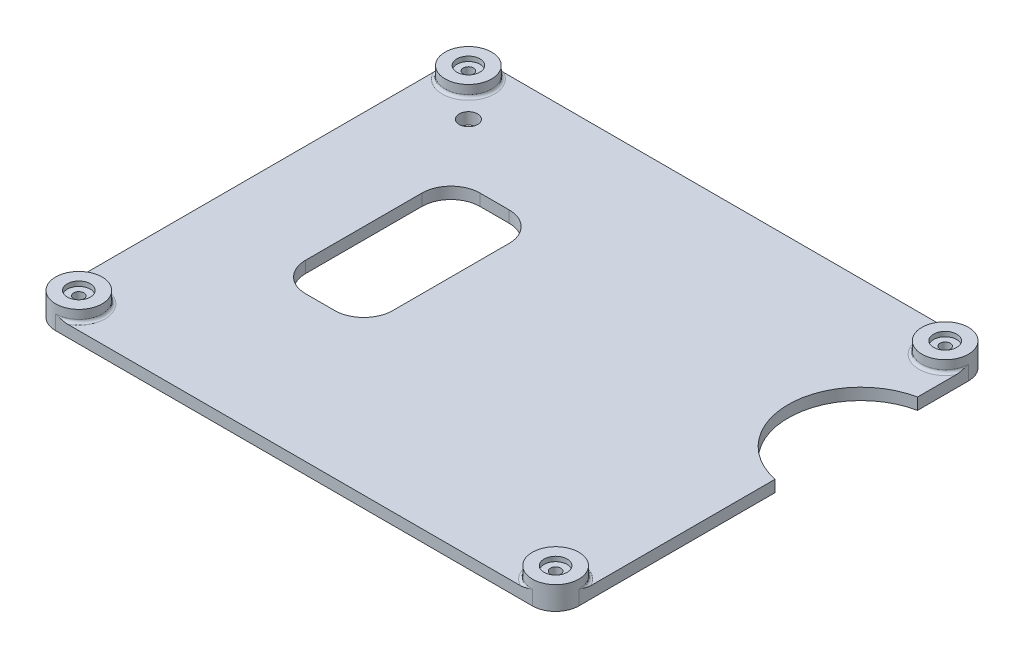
SolidWorks part; units mm, degrees
ref_plane "Front Plane" through (0, 0, 0) normal (0, 0, 1) x (1, 0, 0)
ref_plane "Top Plane" through (0, 0, 0) normal (0, 1, 0) x (1, 0, 0)
ref_plane "Right Plane" through (0, 0, 0) normal (1, 0, 0) x (0, 0, -1)
sketch "Sketch1" plane through (0, 0, 0) normal (0, 1, 0) x (1, 0, 0)
  line L1 (-45, -37.5) -> (45, -37.5)
  line L2 (-45, -37.5) -> (-45, 37.5)
  line L3 (-45, 37.5) -> (45, 37.5)
  line L4 (45, -37.5) -> (45, 37.5)
  line L5 (0, -37.5) -> (0, 37.5) construction
  dimension "D1" = 90
  dimension "D2" = 75
extrude "plate" add sketch "Sketch1" along normal blind 2
fillet "fillet.plate corners" radius 4 4 edges at (45, 1, 37.5) (45, 1, -37.5) (-45, 1, -37.5) (-45, 1, 37.5)
sketch "Sketch12" plane through (0, 2, 0) normal (0, 1, 0) x (-1, 0, 0)
  line L1 (-41, -37.5) -> (41, -37.5) construction
  line L2 (-45, 33.5) -> (-45, -33.5) construction
  arc A1 (-45, -24.7474) -> (-45, -0.2526) centre (-47.5, -12.5) ccw
  dimension "D1" = 25
  dimension "D3" = 12.5
  dimension "D2" = 10
extrude "circular cut" cut sketch "Sketch12" against normal through all and the other way through all
sketch "Sketch2" plane through (0, 2, 0) normal (0, 1, 0) x (1, 0, 0)
  line L0 (41, 37.5) -> (-41, 37.5) construction
  line L1 (-23, 17.5) -> (-18, 17.5)
  line L2 (-28, 12.5) -> (-28, -7.5)
  line L3 (-23, -12.5) -> (-18, -12.5)
  line L4 (-13, 12.5) -> (-13, -7.5)
  line L5 (45, -33.5) -> (45, 0.2526) construction
  arc A0 (-23, 17.5) -> (-28, 12.5) centre (-23, 12.5) ccw
  arc A1 (-18, 17.5) -> (-13, 12.5) centre (-18, 12.5) cw
  arc A2 (-18, -12.5) -> (-13, -7.5) centre (-18, -7.5) ccw
  arc A3 (-28, -7.5) -> (-23, -12.5) centre (-23, -7.5) ccw
  dimension "D1" = 5
  dimension "D2" = 15
  dimension "D3" = 30
  dimension "D4" = 58
  dimension "D5" = 20
extrude "rectangular cut" cut sketch "Sketch2" against normal through all
sketch "Sketch7" plane through (0, 2, 0) normal (0, 1, 0) x (1, 0, 0)
  circle A0 centre (-41, -33.5) radius 4
  circle A1 centre (-41, 33.5) radius 4
  circle A2 centre (41, 33.5) radius 4
  circle A3 centre (41, -33.5) radius 4
  arc A4 (41, -37.5) -> (45, -33.5) centre (41, -33.5) ccw construction
  arc A5 (45, 33.5) -> (41, 37.5) centre (41, 33.5) ccw construction
  arc A6 (-41, 37.5) -> (-45, 33.5) centre (-41, 33.5) ccw construction
  arc A7 (-45, -33.5) -> (-41, -37.5) centre (-41, -33.5) ccw construction
extrude "mounting bosses" add sketch "Sketch7" along normal blind 2
hole_wizard "CBORE for #0 Binding Head Machine Screw1" positions "Sketch9" profile "Sketch10" counterbore size "#0" standard "Ansi Inch"
sketch "Sketch9" plane through (0.1008, 4, -0.0125) normal (0, 1, 0) x (-1, 0, 0)
  point P5 (41.1008, -33.4875)
  point P9 (41.1008, 33.5125)
  point P12 (-40.8992, 33.5125)
  point P15 (-40.8992, -33.4875)
sketch "Sketch10" plane through (-41, 4, -33.5) normal (1, 0, 0) x (0, 0, 1)
  line L0 (0, 0) -> (0, 4)
  line L1 (0, 4) -> (0.889, 4)
  line L3 (0.889, 4) -> (0.889, 0.8128)
  line L4 (0.889, 0.8128) -> (1.985, 0.8128)
  line L5 (1.985, 0.8128) -> (1.985, 0)
  line L7 (1.985, 0) -> (0, 0)
  line L11 (0, -6.35) -> (0, 107.95) construction
  dimension "Thru Hole Dia." = 1.778
  dimension "Thru Hole Depth" = 4
  dimension "C'Bore Dia." = 3.97
  dimension "C'Bore Depth" = 0.8128
fillet "fillet.base of mb" radius 0.5 4 edges at (38.1716, 2, 30.6716) (38.1716, 2, -30.6716) (-38.1716, 2, -30.6716)
hole_wizard "1/8 (0.125) Diameter Hole1" positions "Sketch5" profile "Sketch6" hole size "1/8" standard "Ansi Inch"
sketch "Sketch5" plane through (0, 2, 0) normal (0, 1, 0) x (1, 0, 0)
  line L0 (-45, 31.4384) -> (-45, -31.4384) construction
  line L1 (38.9384, 37.5) -> (-38.9384, 37.5) construction
  point P0 (-35, 27.5)
  dimension "D1" = 10
  dimension "D2" = 10
sketch "Sketch6" plane through (-35, 2, -27.5) normal (1, 0, 0) x (0, 0, 1)
  line L0 (0, 0) -> (0, 2)
  line L1 (0, 2) -> (1.5875, 2)
  line L2 (1.5875, 2) -> (1.5875, 0)
  line L5 (1.5875, 0) -> (0, 0)
  line L11 (0, -6.35) -> (0, 107.95) construction
  dimension "Thru Hole Dia." = 3.175
  dimension "Thru Hole Depth" = 2
